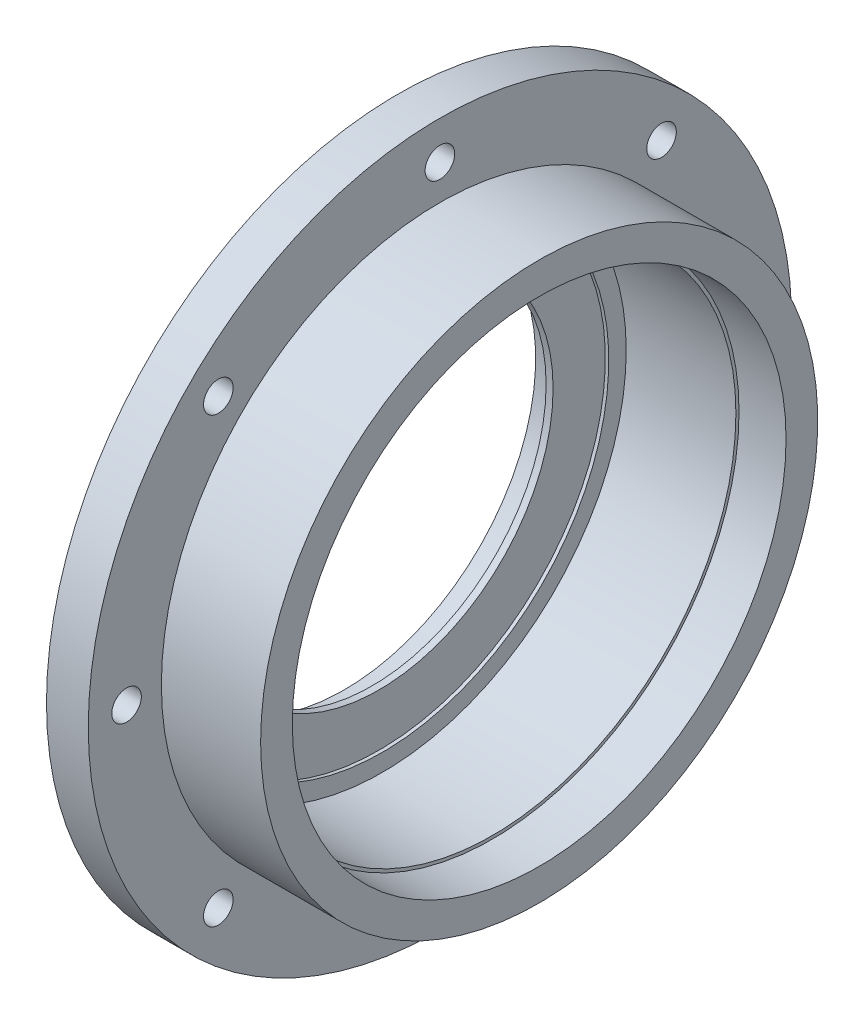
SolidWorks part; units mm, degrees
ref_plane "Face" through (0, 0, 0) normal (0, 0, 1) x (1, 0, 0)
ref_plane "Dessus" through (0, 0, 0) normal (0, 1, 0) x (1, 0, 0)
ref_plane "Droite" through (0, 0, 0) normal (1, 0, 0) x (0, 0, -1)
sketch "Esquisse1" plane through (0, 0, 0) normal (0, 0, 1) x (1, 0, 0)
  line L0 (0, 0) -> (65.2643, 0) construction
  line L1 (11, 70) -> (42.5, 70)
  line L2 (42.5, 70) -> (42.5, 70.9)
  line L3 (10, 65) -> (11, 65)
  line L4 (11, 65) -> (11, 70)
  line L5 (27.5, 80) -> (56, 80)
  line L6 (27.5, 80) -> (27.5, 101)
  line L7 (27.5, 101) -> (15.5, 101)
  line L8 (56, 70.9) -> (56, 80)
  line L9 (0, 55) -> (8, 55)
  line L10 (42.5, 70.9) -> (56, 70.9)
  line L12 (15.5, 101) -> (15.5, 80)
  line L13 (15.5, 80) -> (0, 80)
  line L14 (0, 80) -> (0, 55)
  line L15 (8, 55) -> (8, 50)
  line L16 (8, 50) -> (10, 50)
  line L17 (10, 50) -> (10, 65)
  dimension "D1" = 202
  dimension "D2" = 160
  dimension "D3" = 130
  dimension "D4" = 56
  dimension "D5" = 140
  dimension "D6" = 15.5
  dimension "D7" = 110
  dimension "D8" = 8
  dimension "D9" = 2
  dimension "D10" = 12
  dimension "D11" = 1
  dimension "D12" = 100
  dimension "D13" = 141.8
  dimension "D14" = 13.5
revolve "Révolution1" add sketch "Esquisse1" angle 360 about L0
hole_wizard "Trou taraudé M101" positions "Esquisse3" profile "Esquisse2" tap size "M10" standard "ISO"
sketch "Esquisse3" plane through (15.5, 87.5358, -16.6902) normal (-1, 0, 0) x (0, 0, 1)
  circle A0 centre (16.6902, -87.5358) radius 90 construction
  point P0 (16.6902, 2.4642)
  dimension "D1" = 180
sketch "Esquisse2" plane through (15.5, 90, 0) normal (0, 1, 0) x (0, 0, 1)
  line L0 (0, 0) -> (0, 40.5)
  line L1 (0, 40.5) -> (4.25, 40.5)
  line L2 (4.25, 40.5) -> (4.25, 0)
  line L5 (4.25, 0) -> (0, 0)
  line L11 (0, -6.35) -> (0, 107.95) construction
  dimension "Diamètre du trou pour taraudage jusqu'au prochain" = 8.5
  dimension "Profondeur du trou pour taraudage jusqu'au prochain" = 40.5
chamfer "Chanfrein1" distance 5 angle 45 1 edges at (0, 0, 80)
pattern_circular "Répétition circulaire1" count 8 over 360 about axis through (0, 0, 0) along (1, 0, 0) of "Trou taraudé M101"
sketch "Esquisse4" plane through (0, 0, 0) normal (-1, 0, 0) x (0, 0, 1)
  line L1 (-112.4476, -127.9964) -> (117.8559, -127.9964)
  line L2 (-112.4476, -127.9964) -> (-112.4476, 0)
  line L3 (-112.4476, 0) -> (117.8559, 0)
  line L4 (117.8559, -127.9964) -> (117.8559, 0)
extrude "Enlèv. mat.-Extru.1" [suppressed] cut sketch "Esquisse4" against normal through all
